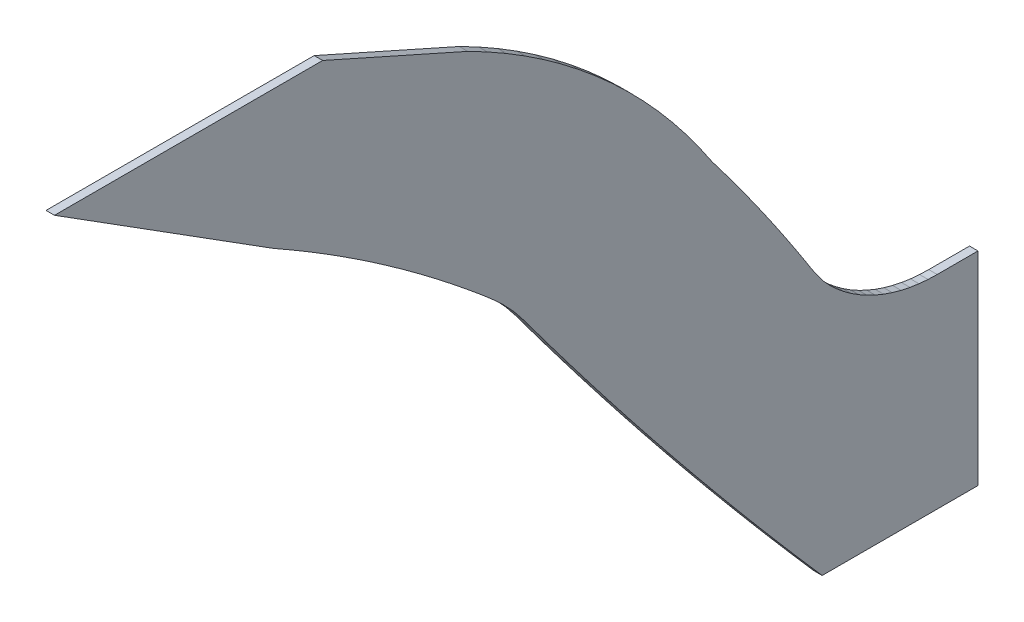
SolidWorks part; units mm, degrees
ref_plane "Plan de face" through (0, 0, 0) normal (0, 0, 1) x (1, 0, 0)
ref_plane "Plan de dessus" through (0, 0, 0) normal (0, 1, 0) x (1, 0, 0)
ref_plane "Plan de droite" through (0, 0, 0) normal (1, 0, 0) x (0, 0, -1)
ref_plane "Plan1" through (2132.0031, 0, 0) normal (-1, 0, 0) x (0, 0, 1)
sketch "Esquisse22" plane through (2132.0031, 0, 0) normal (-1, 0, 0) x (0, 0, 1)
  line L81 (184.061, -1651.829) -> (0, -1651.83)
  line L82 (209.8207, -1622.2494) -> (184.061, -1651.829)
  line L83 (235.4098, -1592.5229) -> (209.8207, -1622.2494)
  line L84 (260.8276, -1562.6497) -> (235.4098, -1592.5229)
  line L85 (286.0734, -1532.6312) -> (260.8276, -1562.6497)
  line L86 (311.1464, -1502.4681) -> (286.0734, -1532.6312)
  line L87 (336.0457, -1472.1614) -> (311.1464, -1502.4681)
  line L88 (360.7705, -1441.7123) -> (336.0457, -1472.1614)
  line L89 (360.7705, -1441.7123) -> (385.3199, -1411.1216)
  line L90 (385.3199, -1411.1216) -> (409.6932, -1380.3903)
  line L91 (409.6932, -1380.3903) -> (433.8895, -1349.5196)
  line L92 (433.8895, -1349.5196) -> (457.9082, -1318.5104)
  line L93 (457.9082, -1318.5104) -> (481.7482, -1287.3636)
  line L94 (481.7482, -1287.3636) -> (505.409, -1256.0805)
  line L95 (505.409, -1256.0805) -> (528.8896, -1224.6619)
  line L96 (528.8896, -1224.6619) -> (552.189, -1193.11)
  line L97 (552.189, -1193.11) -> (569.4536, -1177.9656)
  line L98 (569.4536, -1177.9656) -> (586.9328, -1163.0694)
  line L99 (586.9328, -1163.0694) -> (604.6228, -1148.424)
  line L100 (604.6228, -1148.424) -> (622.5201, -1134.0327)
  line L101 (640.6209, -1119.8984) -> (622.5201, -1134.0327)
  line L102 (658.9217, -1106.0238) -> (640.6209, -1119.8984)
  line L103 (677.4186, -1092.4119) -> (658.9217, -1106.0238)
  line L104 (696.108, -1079.0654) -> (677.4186, -1092.4119)
  line L105 (714.986, -1065.9871) -> (696.108, -1079.0654)
  line L106 (734.0488, -1053.1795) -> (714.986, -1065.9871)
  line L107 (753.2924, -1040.6454) -> (734.0488, -1053.1795)
  line L108 (772.713, -1028.3872) -> (753.2924, -1040.6454)
  line L109 (772.713, -1028.3872) -> (792.3065, -1016.4075)
  line L110 (792.3065, -1016.4075) -> (812.0691, -1004.7086)
  line L111 (812.0691, -1004.7086) -> (831.997, -993.293)
  line L112 (831.997, -993.293) -> (1090.801, -830)
  line L113 (774.0381, -830) -> (1090.801, -830)
  line L114 (774.0381, -830) -> (602.777, -906.32)
  line L115 (602.777, -906.32) -> (579.7193, -918.4061)
  line L116 (579.7193, -918.4061) -> (557.0983, -931.2908)
  line L117 (557.0983, -931.2908) -> (534.9415, -944.9584)
  line L118 (534.9415, -944.9584) -> (513.276, -959.3922)
  line L119 (513.276, -959.3922) -> (492.1284, -974.5746)
  line L120 (492.1284, -974.5746) -> (471.5244, -990.4869)
  line L121 (471.5244, -990.4869) -> (451.4894, -1007.1099)
  line L122 (451.4894, -1007.1099) -> (432.0476, -1024.423)
  line L123 (432.0476, -1024.423) -> (413.223, -1042.4051)
  line L124 (395.0385, -1061.0344) -> (413.223, -1042.4051)
  line L125 (377.5164, -1080.2881) -> (395.0385, -1061.0344)
  line L126 (360.678, -1100.1425) -> (377.5164, -1080.2881)
  line L127 (344.544, -1120.5733) -> (360.678, -1100.1425)
  line L128 (329.1341, -1141.5557) -> (344.544, -1120.5733)
  line L129 (314.467, -1163.064) -> (329.1341, -1141.5557)
  line L130 (305.5752, -1174.7535) -> (314.467, -1163.064)
  line L131 (296.7572, -1186.4983) -> (305.5752, -1174.7535)
  line L132 (288.0129, -1198.298) -> (296.7572, -1186.4983)
  line L133 (279.3426, -1210.1521) -> (288.0129, -1198.298)
  line L134 (270.7466, -1222.0603) -> (279.3426, -1210.1521)
  line L135 (262.2252, -1234.022) -> (270.7466, -1222.0603)
  line L136 (253.7788, -1246.0368) -> (262.2252, -1234.022)
  line L137 (245.4078, -1258.1042) -> (253.7788, -1246.0368)
  line L138 (237.1124, -1270.2236) -> (245.4078, -1258.1042)
  line L139 (228.8929, -1282.3948) -> (237.1124, -1270.2236)
  line L140 (220.7498, -1294.6171) -> (228.8929, -1282.3948)
  line L141 (212.6832, -1306.8901) -> (220.7498, -1294.6171)
  line L142 (204.6936, -1319.2134) -> (212.6832, -1306.8901)
  line L143 (204.6936, -1319.2134) -> (196.7813, -1331.5862)
  line L144 (196.7813, -1331.5862) -> (188.947, -1344.009)
  line L145 (181.9835, -1352.23) -> (188.947, -1344.009)
  line L146 (174.5406, -1360.0196) -> (181.9835, -1352.23)
  line L147 (174.5406, -1360.0196) -> (166.645, -1367.3499)
  line L148 (166.645, -1367.3499) -> (158.325, -1374.1946)
  line L149 (149.6104, -1380.5294) -> (158.325, -1374.1946)
  line L150 (140.5323, -1386.3316) -> (149.6104, -1380.5294)
  line L151 (140.5323, -1386.3316) -> (131.1235, -1391.5801)
  line L152 (131.1235, -1391.5801) -> (121.4175, -1396.2563)
  line L153 (111.4491, -1400.3435) -> (121.4175, -1396.2563)
  line L154 (111.4491, -1400.3435) -> (101.254, -1403.827)
  line L155 (101.254, -1403.827) -> (90.8688, -1406.6943)
  line L156 (90.8688, -1406.6943) -> (80.3307, -1408.9351)
  line L157 (69.6773, -1410.5414) -> (80.3307, -1408.9351)
  line L158 (69.6773, -1410.5414) -> (58.947, -1411.5076)
  line L159 (48.178, -1411.8299) -> (58.947, -1411.5076)
  line L160 (0, -1411.8299) -> (48.178, -1411.8299)
  line L161 (0, -1411.8299) -> (0, -1651.83)
extrude "Boss.-Extru.1" add sketch "Esquisse22" against normal blind 10
fillet "Congé1" radius 250 4 edges at (2137.0031, -1163.064, 314.467) (2137.0031, -1193.11, 552.189) (2137.0031, -1344.009, 188.947) (2137.0031, -1352.23, 181.9835)
